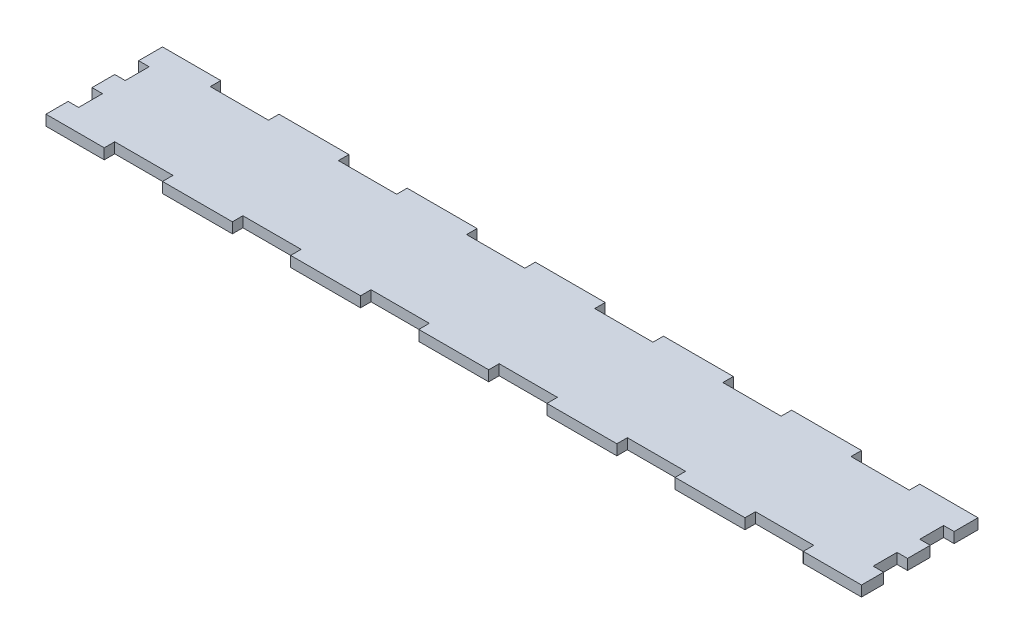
SolidWorks part; units mm, degrees
ref_plane "Front Plane" through (0, 0, 0) normal (0, 0, 1) x (1, 0, 0)
ref_plane "Top Plane" through (0, 0, 0) normal (0, 1, 0) x (1, 0, 0)
ref_plane "Right Plane" through (0, 0, 0) normal (1, 0, 0) x (0, 0, -1)
sketch "Sketch1" plane through (0, 0, 0) normal (0, 1, 0) x (1, 0, 0)
  line L1 (-350, 50) -> (350, 50)
  line L2 (-350, 50) -> (-350, 29.5)
  line L3 (-350, -50) -> (350, -50)
  line L4 (350, 50) -> (350, 29.5)
  line L5 (-350, 50) -> (350, -50) construction
  line L6 (-350, -50) -> (350, 50) construction
  line L7 (-350, 29.5) -> (-341, 29.5)
  line L9 (-350, 9) -> (-341, 9)
  line L10 (-341, 29.5) -> (-341, 9)
  line L11 (-350, -10.5) -> (-341, -10.5)
  line L12 (-341, -10.5) -> (-341, -31)
  line L13 (-350, -31) -> (-341, -31)
  line L14 (0, 131.3384) -> (0, -134.3722) construction
  line L15 (350, 9) -> (341, 9)
  line L16 (341, 29.5) -> (341, 9)
  line L17 (350, 29.5) -> (341, 29.5)
  line L19 (350, -10.5) -> (341, -10.5)
  line L20 (341, -10.5) -> (341, -31)
  line L21 (350, -31) -> (341, -31)
  line L23 (350, 9) -> (350, -10.5)
  line L24 (350, -31) -> (350, -50)
  line L26 (-350, -31) -> (-350, -50)
  line L27 (-350, 9) -> (-350, -10.5)
  point P0 (0, 0)
  dimension "D1" = 100
  dimension "D2" = 700
  dimension "D3" = 20.5
  dimension "D4" = 20.5
  dimension "D6" = 9
  dimension "D5" = 2
extrude "Boss-Extrude1" add sketch "Sketch1" along normal blind 9
sketch "Sketch2" plane through (0, 9, 0) normal (0, 1, 0) x (1, 0, 0)
  line L0 (350, 50) -> (-350, 50) construction
  line L1 (-300, 50) -> (-250, 50)
  line L2 (-300, 50) -> (-300, 41)
  line L3 (-300, 41) -> (-250, 41)
  line L4 (-250, 50) -> (-250, 41)
  line L5 (-190, 50) -> (-190, 41)
  line L6 (-190, 50) -> (-140, 50)
  line L7 (-140, 50) -> (-140, 41)
  line L8 (-190, 41) -> (-140, 41)
  line L9 (-80, 50) -> (-80, 41)
  line L10 (-80, 50) -> (-30, 50)
  line L11 (-30, 50) -> (-30, 41)
  line L12 (-80, 41) -> (-30, 41)
  line L13 (30, 50) -> (30, 41)
  line L14 (30, 50) -> (80, 50)
  line L15 (80, 50) -> (80, 41)
  line L16 (30, 41) -> (80, 41)
  line L17 (140, 50) -> (140, 41)
  line L18 (140, 50) -> (190, 50)
  line L19 (190, 50) -> (190, 41)
  line L20 (140, 41) -> (190, 41)
  line L21 (250, 50) -> (250, 41)
  line L22 (250, 50) -> (300, 50)
  line L23 (300, 50) -> (300, 41)
  line L24 (250, 41) -> (300, 41)
  line L25 (-359.8206, 0) -> (369.5266, 0) construction
  line L26 (250, -50) -> (300, -50)
  line L27 (300, -50) -> (300, -41)
  line L28 (250, -41) -> (300, -41)
  line L29 (250, -50) -> (250, -41)
  line L30 (140, -50) -> (190, -50)
  line L31 (190, -50) -> (190, -41)
  line L32 (140, -41) -> (190, -41)
  line L33 (140, -50) -> (140, -41)
  line L34 (30, -50) -> (80, -50)
  line L35 (80, -50) -> (80, -41)
  line L36 (30, -41) -> (80, -41)
  line L37 (30, -50) -> (30, -41)
  line L38 (-80, -50) -> (-30, -50)
  line L39 (-30, -50) -> (-30, -41)
  line L40 (-80, -41) -> (-30, -41)
  line L41 (-80, -50) -> (-80, -41)
  line L42 (-190, -50) -> (-140, -50)
  line L43 (-140, -50) -> (-140, -41)
  line L44 (-190, -41) -> (-140, -41)
  line L45 (-190, -50) -> (-190, -41)
  line L46 (-300, -41) -> (-250, -41)
  line L47 (-250, -50) -> (-250, -41)
  line L48 (-300, -50) -> (-250, -50)
  line L49 (-300, -50) -> (-300, -41)
  dimension "D1" = 50
  dimension "D2" = 50
  dimension "D4" = 9
  dimension "D3" = 6
extrude "Cut-Extrude1" cut sketch "Sketch2" against normal blind 9
